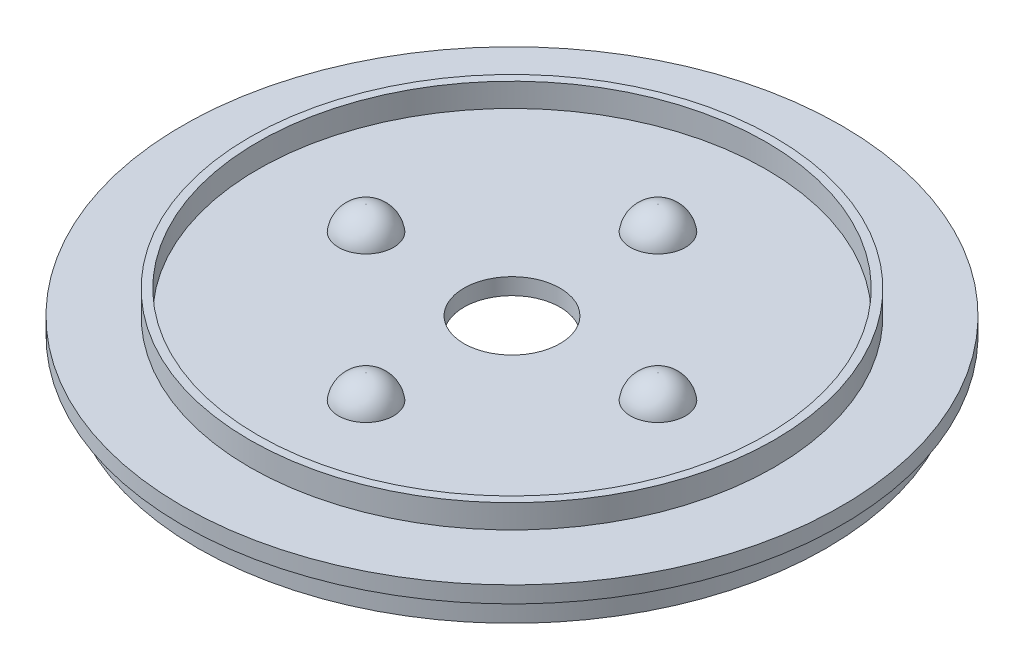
SolidWorks part; units mm, degrees
ref_plane "Front Plane" through (0, 0, 0) normal (0, 0, 1) x (1, 0, 0)
ref_plane "Top Plane" through (0, 0, 0) normal (0, 1, 0) x (1, 0, 0)
ref_plane "Right Plane" through (0, 0, 0) normal (1, 0, 0) x (0, 0, -1)
sketch "Sketch3" plane through (0, 0, 0) normal (0, 1, 0) x (1, 0, 0)
  circle A0 centre (0, 0) radius 60
  circle A1 centre (0, 0) radius 8.75
  dimension "D1" = 120
  dimension "D2" = 17.5
extrude "Boss-Extrude1" add sketch "Sketch3" along normal blind 3
sketch "Sketch4" plane through (0, 0, 0) normal (0, -1, 0) x (1, 0, 0)
  circle A0 centre (0, 0) radius 57.25
  circle A1 centre (0, 0) radius 55.75
  dimension "D1" = 114.5
  dimension "D2" = 111.5
extrude "Boss-Extrude2" add sketch "Sketch4" along normal blind 5
sketch "Sketch5" plane through (0, 0, 0) normal (0, -1, 0) x (1, 0, 0)
  circle A0 centre (0, 0) radius 22
  circle A1 centre (0, 0) radius 20.5
  dimension "D1" = 44
  dimension "D2" = 41
extrude "Boss-Extrude3" add sketch "Sketch5" along normal blind 7
sketch "Sketch6" plane through (0, 3, 0) normal (0, 1, 0) x (1, 0, 0)
  circle A0 centre (0, 0) radius 47.75
  circle A1 centre (0, 0) radius 46.25
  dimension "D1" = 95.5
  dimension "D2" = 92.5
extrude "Boss-Extrude4" add sketch "Sketch6" along normal blind 4.3
sketch "Sketch10" plane through (0, 3, 0) normal (0, 1, 0) x (1, 0, 0)
  line L0 (0, 18.6634) -> (0, 34.4865) construction
  circle A0 centre (0, 26.575) radius 5
  circle A2 centre (26.575, 0) radius 5
  circle A3 centre (0, -26.575) radius 5
  circle A4 centre (-26.575, 0) radius 5
  point P16 (0, 0)
  dimension "D1" = 10
  dimension "D2" = 4
extrude "Boss-Extrude5" add sketch "Sketch10" along normal up to surface (4.3 mm away)
fillet "Fillet2" radius 5 4 edges at (0, 7.3, 31.575) (26.575, 7.3, 5) (0, 7.3, -21.575) (-26.575, 7.3, 5)
